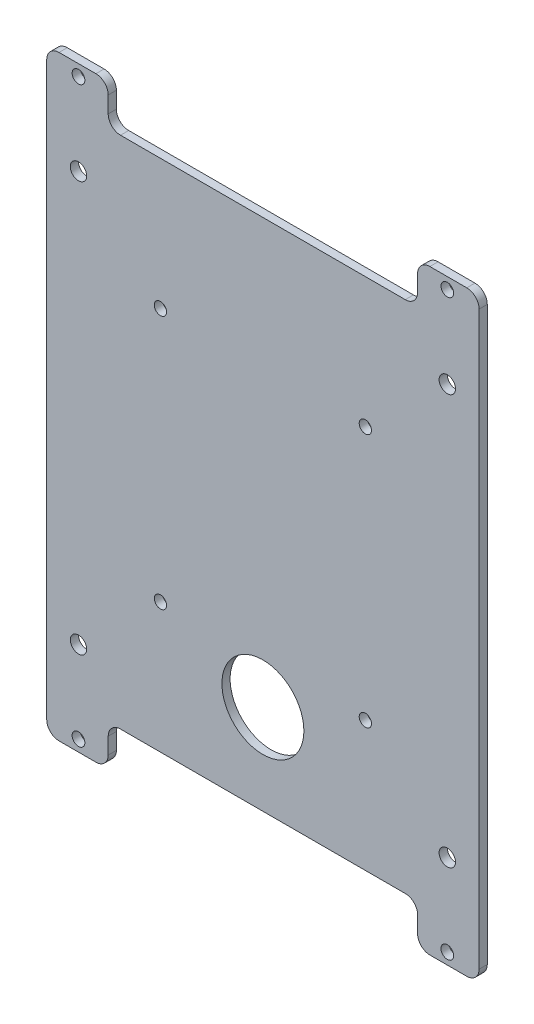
SolidWorks part; units mm, degrees
ref_plane "前视基准面" through (0, 0, 0) normal (0, 0, 1) x (1, 0, 0)
ref_plane "上视基准面" through (0, 0, 0) normal (0, 1, 0) x (1, 0, 0)
ref_plane "右视基准面" through (0, 0, 0) normal (1, 0, 0) x (0, 0, -1)
sketch "草图1" plane through (0, 0, 0) normal (0, 0, 1) x (1, 0, 0)
  line L0 (0, 0) -> (0, 60.75) construction
  line L1 (-52.75, -60.75) -> (52.75, -60.75)
  line L2 (-52.75, -60.75) -> (-52.75, 60.75)
  line L3 (-52.75, 60.75) -> (52.75, 60.75)
  line L4 (52.75, -60.75) -> (52.75, 60.75)
  line L5 (-52.75, -60.75) -> (52.75, 60.75) construction
  line L6 (-52.75, 60.75) -> (52.75, -60.75) construction
  line L7 (0, 0) -> (-52.75, 0) construction
  circle A0 centre (-45, 50) radius 2
  circle A1 centre (-25, 31) radius 1.5
  circle A2 centre (45, 50) radius 2
  circle A3 centre (45, -50) radius 2
  circle A4 centre (-45, -50) radius 2
  circle A5 centre (25, 31) radius 1.5
  circle A6 centre (25, -31) radius 1.5
  circle A7 centre (-25, -31) radius 1.5
  circle A8 centre (0, -40.75) radius 10
  point P0 (0, 0)
  dimension "D3" = 3
  dimension "D4" = 4
  dimension "D5" = 90
  dimension "D6" = 100
  dimension "D7" = 50
  dimension "D8" = 62
  dimension "D13" = 20
  dimension "D14" = 20
  dimension "D1" = 105.5
  dimension "D2" = 121.5
  dimension "D9" = 2
  dimension "D10" = 2
  dimension "D11" = 2
  dimension "D12" = 2
extrude "凸台-拉伸1" add sketch "草图1" along normal blind 2
sketch "草图2" plane through (0, 0, 2) normal (0, 0, 1) x (1, 0, 0)
  line L0 (-45, -50) -> (-45, -86.5156) construction
  line L1 (-52.75, -60.75) -> (52.75, -60.75)
  line L2 (-52.75, -60.75) -> (-52.75, -72.75)
  line L3 (-52.75, -72.75) -> (52.75, -72.75)
  line L4 (52.75, -60.75) -> (52.75, -72.75)
  line L5 (45, -50) -> (45, -86.5156) construction
  line L6 (52.75, 0) -> (-52.75, 0) construction
  line L7 (52.75, -60.75) -> (52.75, 60.75) construction
  line L8 (-52.75, 60.75) -> (-52.75, -60.75) construction
  line L9 (45, 50) -> (45, 86.5156) construction
  line L10 (-45, 50) -> (-45, 86.5156) construction
  line L11 (52.75, 60.75) -> (52.75, 72.75)
  line L12 (-52.75, 72.75) -> (52.75, 72.75)
  line L13 (-52.75, 60.75) -> (-52.75, 72.75)
  line L14 (-52.75, 60.75) -> (52.75, 60.75)
  circle A0 centre (-45, -70) radius 1.55
  circle A1 centre (45, -70) radius 1.55
  circle A2 centre (45, 70) radius 1.55
  circle A3 centre (-45, 70) radius 1.55
  dimension "D3" = 3.1
  dimension "D4" = 9.25
  dimension "D5" = 9.25
  dimension "D1" = 12
extrude "凸台-拉伸2" add sketch "草图2" against normal up to surface (2 mm away)
sketch "草图3" plane through (0, 0, 2) normal (0, 0, 1) x (1, 0, 0)
  line L0 (52.75, 72.75) -> (-52.75, 72.75) construction
  line L1 (-37.75, 72.75) -> (37.75, 72.75)
  line L2 (-37.75, 72.75) -> (-37.75, 62.75)
  line L3 (-37.75, 62.75) -> (37.75, 62.75)
  line L4 (37.75, 72.75) -> (37.75, 62.75)
  line L5 (-52.75, 72.75) -> (-52.75, -72.75) construction
  line L6 (52.75, -72.75) -> (52.75, 72.75) construction
  line L7 (0, 0) -> (79.4019, 0) construction
  line L8 (37.75, -72.75) -> (37.75, -62.75)
  line L9 (-37.75, -62.75) -> (37.75, -62.75)
  line L10 (-37.75, -72.75) -> (-37.75, -62.75)
  line L11 (-37.75, -72.75) -> (37.75, -72.75)
  dimension "D1" = 10
  dimension "D2" = 15
  dimension "D3" = 15
extrude "切除-拉伸1" cut sketch "草图3" against normal blind 10
fillet "圆角1" radius 3 12 edges at (52.75, -72.75, 1) (37.75, -72.75, 1) (37.75, -62.75, 1) (-37.75, -62.75, 1) (-37.75, -72.75, 1) (-52.75, -72.75, 1) (52.75, 72.75, 1) (37.75, 72.75, 1) (37.75, 62.75, 1) (-37.75, 62.75, 1) (-37.75, 72.75, 1) (-52.75, 72.75, 1)
